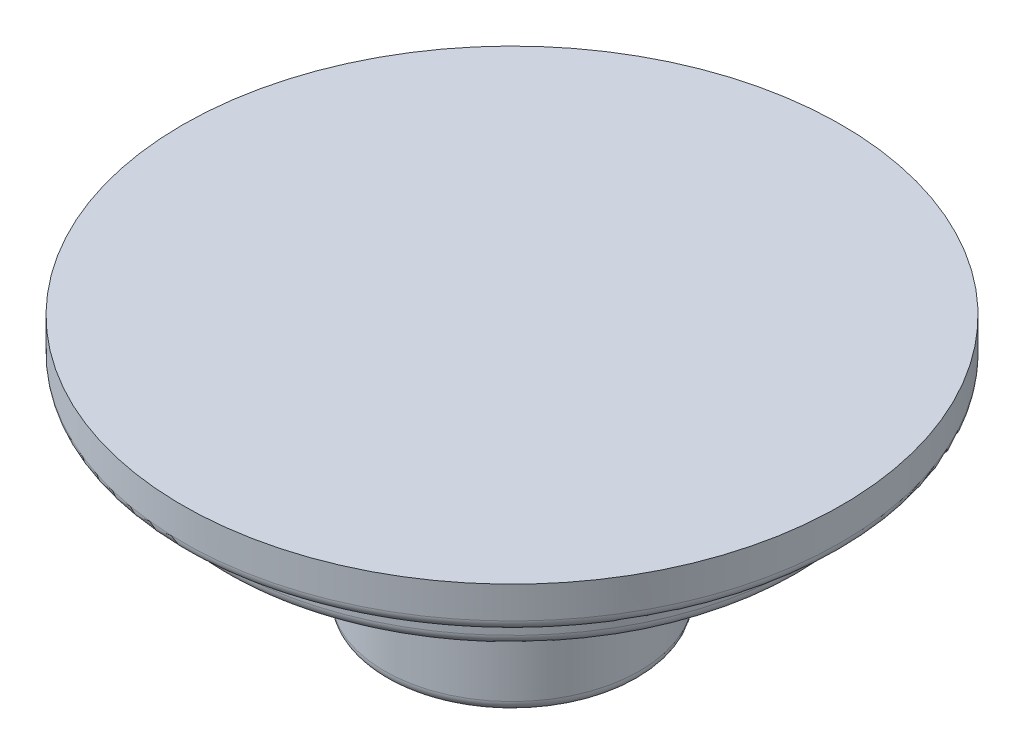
SolidWorks part; units mm, degrees
ref_plane "Front" through (0, 0, 0) normal (0, 0, 1) x (1, 0, 0)
ref_plane "Top" through (0, 0, 0) normal (0, 1, 0) x (1, 0, 0)
ref_plane "Right" through (0, 0, 0) normal (1, 0, 0) x (0, 0, -1)
sketch "Sketch1" plane through (0, 0, 0) normal (0, 0, 1) x (1, 0, 0)
  line L0 (0, 0) -> (0, -79.375) construction
  line L1 (0, -36.5125) -> (-49.2125, -36.5125)
  line L2 (-49.2125, -36.5125) -> (-49.2125, -42.8625)
  line L3 (-49.2125, -42.8625) -> (-42.8625, -42.8625)
  line L4 (-42.8625, -42.8625) -> (-42.8625, -49.2125)
  line L5 (-42.8625, -49.2125) -> (-19.05, -49.2125)
  line L6 (-19.05, -49.2125) -> (-19.05, -74.6125)
  line L7 (-19.05, -74.6125) -> (-12.7, -74.6125)
  line L8 (-12.7, -74.6125) -> (-12.7, -52.3875)
  line L9 (-12.7, -52.3875) -> (0, -52.3875)
  line L10 (0, -52.3875) -> (0, -36.5125)
  line L11 (-42.8625, -46.0375) -> (-42.8625, -61.9125) construction
  line L12 (-49.2125, -1.5875) -> (-49.2125, -42.8625) construction
  line L13 (49.2125, -42.8625) -> (-49.2125, -42.8625) construction
  dimension "D1" = 6.35
  dimension "D2" = 6.35
  dimension "D3" = 25.4
  dimension "D4" = 25.4
  dimension "D5" = 38.1
  dimension "D6" = 22.225
revolve "Revolve1" add sketch "Sketch1" angle 360 about L0
fillet "Fillet1" radius 1.5875 7 edges at (-12.7, -52.3875, 0) (-12.7, -74.6125, 0) (-19.05, -74.6125, 0) (-19.05, -49.2125, 0) (-42.8625, -49.2125, 0) (-42.8625, -42.8625, 0) (-49.2125, -42.8625, 0)
